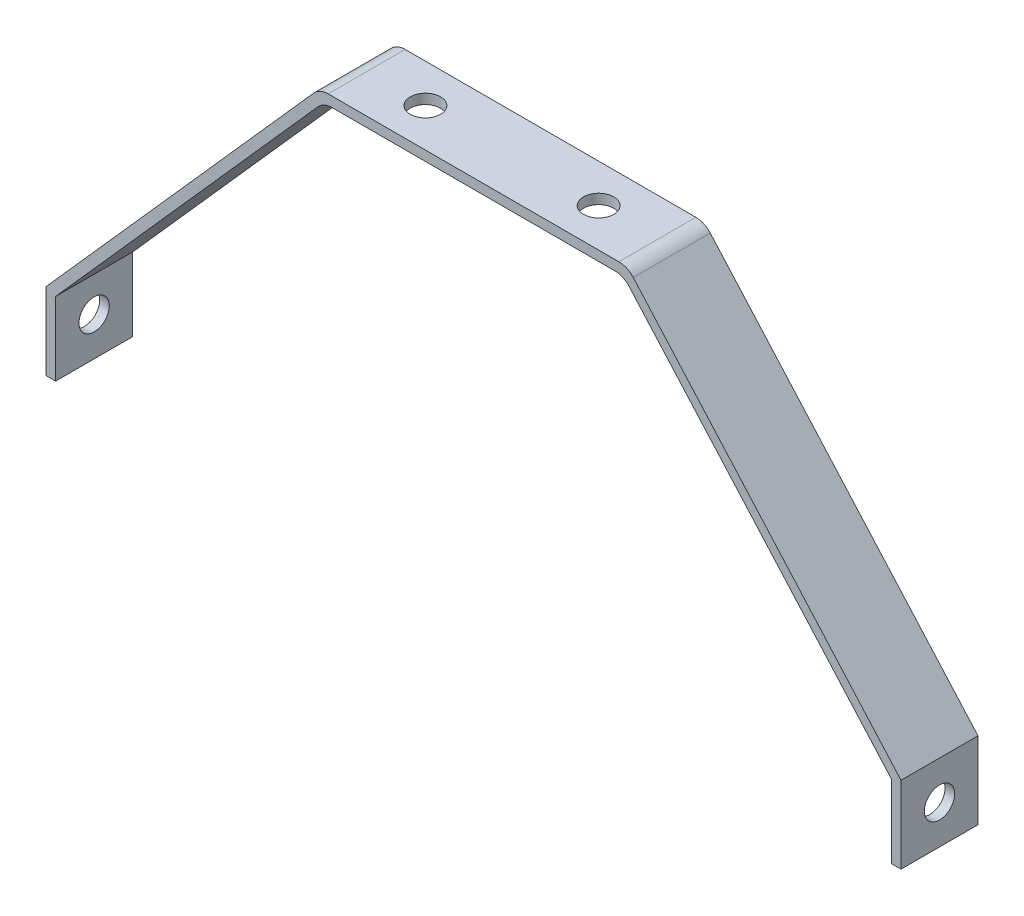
SolidWorks part; units mm, degrees
ref_plane "Front Plane" through (0, 0, 0) normal (0, 0, 1) x (1, 0, 0)
ref_plane "Top Plane" through (0, 0, 0) normal (0, 1, 0) x (1, 0, 0)
ref_plane "Right Plane" through (0, 0, 0) normal (1, 0, 0) x (0, 0, -1)
sketch "Sketch1" plane through (0, 0, 0) normal (0, 0, 1) x (1, 0, 0)
  line L0 (0, 75.3425) -> (0, -94.2079) construction
  line L1 (-141.0088, -19.742) -> (-141.0088, -45.142)
  line L2 (-141.0088, -45.142) -> (-137.8338, -45.142)
  line L3 (-137.8338, -45.142) -> (-137.8338, -20.9481)
  line L4 (52.6947, 79.7241) -> (141.0088, -19.742)
  line L5 (47.9463, 81.858) -> (-47.9463, 81.858)
  line L6 (-52.6947, 79.7241) -> (-141.0088, -19.742)
  line L7 (51.3479, 76.4589) -> (137.8338, -20.9481)
  line L8 (46.5994, 78.5929) -> (-46.5994, 78.5929)
  line L9 (-51.3479, 76.4589) -> (-137.8338, -20.9481)
  line L12 (141.0088, -45.142) -> (137.8338, -45.142)
  line L13 (137.8338, -45.142) -> (137.8338, -20.9481)
  line L14 (141.0088, -19.742) -> (141.0088, -45.142)
  line L15 (-141.0088, -32.442) -> (-171.9536, -32.442) construction
  arc A0 (-47.9463, 81.858) -> (-52.6947, 79.7241) centre (-47.9463, 75.508) ccw
  arc A1 (-46.5994, 78.5929) -> (-51.3479, 76.4589) centre (-46.5994, 72.2429) ccw
  arc A2 (51.3479, 76.4589) -> (46.5994, 78.5929) centre (46.5994, 72.2429) ccw
  arc A3 (52.6947, 79.7241) -> (47.9463, 81.858) centre (47.9463, 75.508) ccw
  point P7 (0, 80.2705)
  point P20 (-50.8, 81.858)
  point P27 (50.8, 81.858)
  dimension "D7" = 6.35
  dimension "D8" = 6.35
  dimension "D9" = 6.35
  dimension "D10" = 6.35
  dimension "D1" = 114.3
  dimension "D2" = 25.4
  dimension "D3" = 3.175
  dimension "D4" = 3.175
  dimension "D5" = 3.175
  dimension "D6" = 101.6
extrude "Boss-Extrude3" add sketch "Sketch1" along normal blind 25.4
sketch "Sketch2" plane through (141.0088, 0, 0) normal (1, 0, 0) x (0, 0, -1)
  line L0 (-12.7, -45.142) -> (-12.7, -19.742) construction
  line L1 (-25.4, -45.142) -> (0, -45.142) construction
  line L2 (-25.4, -19.742) -> (0, -19.742) construction
  circle A0 centre (-12.7, -32.442) radius 5
  dimension "D1" = 10
extrude "Cut-Extrude1" cut sketch "Sketch2" against normal through all both and the other way through all
sketch "Sketch4" plane through (0, 81.858, 0) normal (0, 1, 0) x (1, 0, 0)
  line L0 (-47.9463, -12.7) -> (-28.575, -12.7) construction
  line L1 (-47.9463, -25.4) -> (-47.9463, 0) construction
  line L2 (0, -25.4) -> (0, 0) construction
  line L3 (47.9463, -25.4) -> (-47.9463, -25.4) construction
  circle A0 centre (-28.575, -12.7) radius 5
  circle A1 centre (28.575, -12.7) radius 5
  dimension "D1" = 10
  dimension "D2" = 28.575
extrude "Cut-Extrude2" cut sketch "Sketch4" against normal through all both and the other way through all
